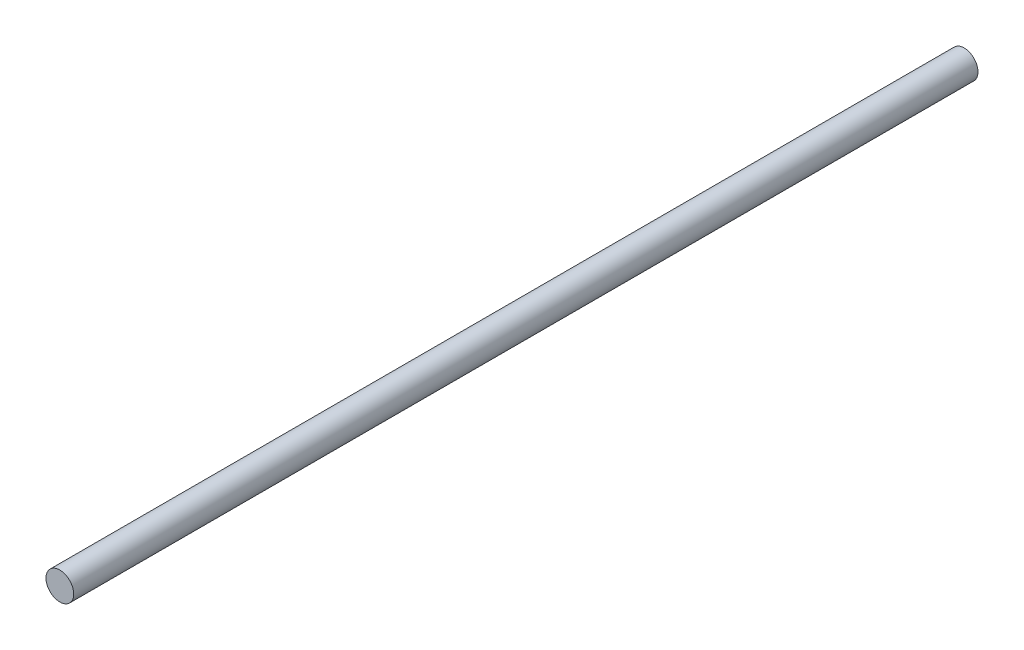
SolidWorks part; units mm, degrees
ref_plane "Plan de face" through (0, 0, 0) normal (0, 0, 1) x (1, 0, 0)
ref_plane "Plan de dessus" through (0, 0, 0) normal (0, 1, 0) x (1, 0, 0)
ref_plane "Plan de droite" through (0, 0, 0) normal (1, 0, 0) x (0, 0, -1)
sketch "Esquisse1" plane through (0, 0, 0) normal (0, 0, 1) x (1, 0, 0)
  circle A0 centre (0, 0) radius 9.9617
extrude "Extrusion1" add sketch "Esquisse1" along normal mid plane 650
sketch "Esquisse2" plane through (0, 0, 0) normal (0, 1, 0) x (1, 0, 0)
  point P0 (0, 0)
